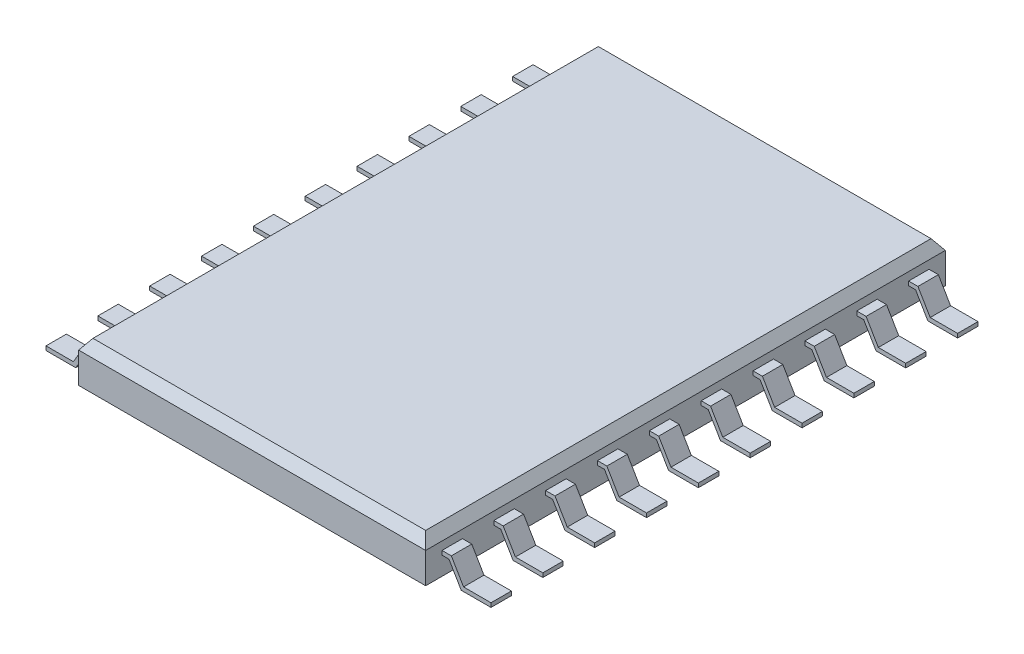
SolidWorks part; units mm, degrees
ref_plane "Front Plane" through (0, 0, 0) normal (0, 0, 1) x (1, 0, 0)
ref_plane "Top Plane" through (0, 0, 0) normal (0, 1, 0) x (1, 0, 0)
ref_plane "Right Plane" through (0, 0, 0) normal (1, 0, 0) x (0, 0, -1)
sketch "Sketch1" plane through (0, 0, 0) normal (0, 1, 0) x (1, 0, 0)
  line L0 (0, 6.8835) -> (0, -6.8835) construction
  line L1 (-5.5575, 0) -> (5.5575, 0) construction
  line L3 (-4.25, 7) -> (4.25, 7)
  line L4 (-4.25, 7) -> (-4.25, -7)
  line L5 (-4.25, -7) -> (4.25, -7)
  line L6 (4.25, 7) -> (4.25, -7)
  dimension "D1" = 8.5
  dimension "D2" = 14
extrude "Extrude1" add sketch "Sketch1" along normal mid plane 1
chamfer "Chamfer1" distance 0.25 angle 35 4 edges at (0, 0.5, -7) (4.25, 0.5, 0) (0, 0.5, 7) (-4.25, 0.5, 0)
sketch "Sketch4" plane through (0, 0, 0) normal (0, 0, 1) x (1, 0, 0)
  line L0 (0, 1.2724) -> (0, -0.9364) construction
  line L1 (-4.25, 1.8525) -> (-4.25, -1.3157) construction
  line L2 (-4.25, 0.25) -> (-4.25, -0.5) construction
  line L3 (0, 0) -> (-6.2695, 0) construction
  line L4 (-5.45, 1.2724) -> (-5.45, -1.1019) construction
  line L5 (-4.25, 0) -> (-4.45, 0)
  line L6 (-4.45, 0) -> (-4.75, -0.51)
  line L7 (-4.75, -0.51) -> (-5.45, -0.51)
  line L9 (-4.25, -0.5) -> (4.25, -0.5) construction
  point P19 (-4.45, 0)
  point P22 (-4.75, -0.51)
  dimension "D1" = 1.2
  dimension "D2" = 0.01
  dimension "D3" = 0.7
  dimension "D4" = 0.2
extrude "Extrude-Thin1" add sketch "Sketch4" along normal mid plane 0.5 thin
pattern_linear "LPattern1" count 6 spacing 1.27 along (0, 0, -1) count 5 spacing 1.27 along (0, 0, 1) of "Extrude-Thin1"
mirror "Mirror1" about plane through (0, 0, 0) normal (1, 0, 0) of "LPattern1", "Extrude-Thin1"
other "Move Face1" parameters "D1"=1.27
